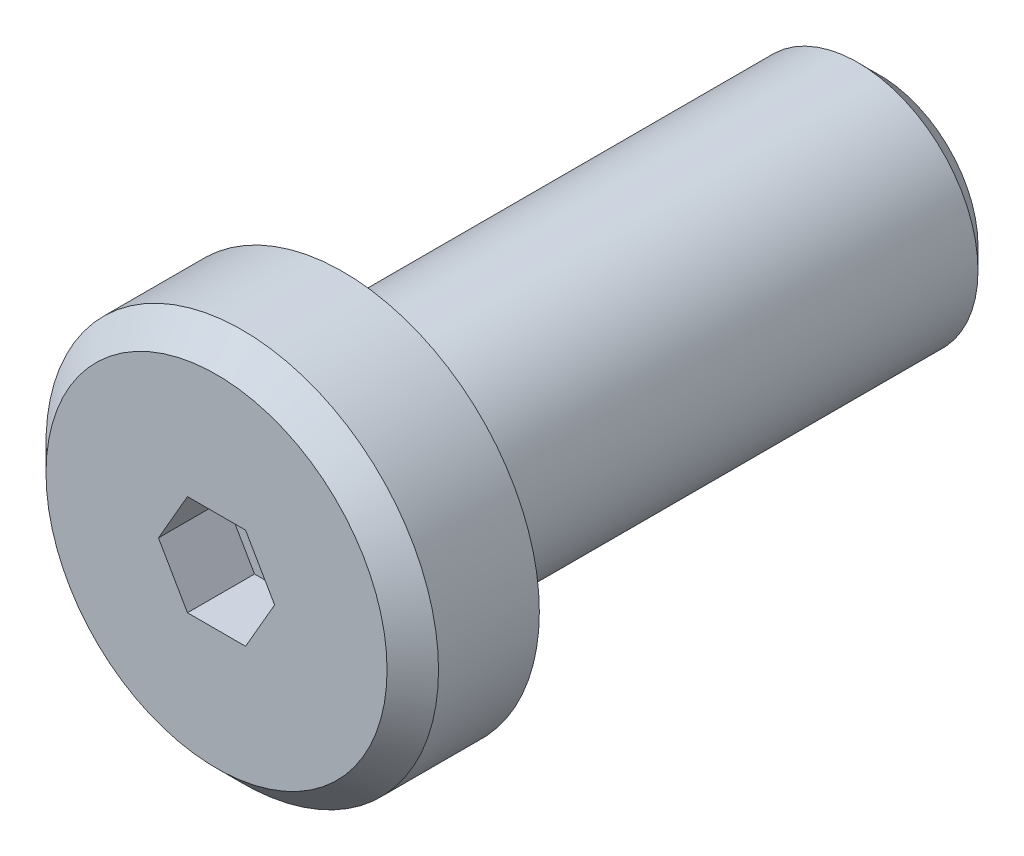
SolidWorks part; units mm, degrees
ref_plane "Plane1" through (0, 0, 0) normal (0, 0, 1) x (1, 0, 0)
ref_plane "Plane2" through (0, 0, 0) normal (0, 1, 0) x (1, 0, 0)
ref_plane "Plane3" through (0, 0, 0) normal (1, 0, 0) x (0, 0, -1)
other "Configuration Table"
sketch "Sketch1" plane through (0, 0, 0) normal (0, 0, 1) x (1, 0, 0)
  circle A0 centre (0, 0) radius 2.3241
  dimension "Head Dia." = 4.6482
extrude "Head" add sketch "Sketch1" against normal blind 1.4986
sketch "Sketch2" plane through (0, 0, -1.4986) normal (0, 0, -1) x (-1, 0, 0)
  circle A0 centre (0, 0) radius 1.4224
  dimension "Shaft O.D." = 2.8448
extrude "Shank" add sketch "Sketch2" along normal blind 6.35
sketch "Sketch3" plane through (0, 0, 0) normal (0, 0, 1) x (1, 0, 0)
  line L1 (0.6878, 0) -> (0.3439, 0.5956)
  line L2 (0.3439, 0.5956) -> (-0.3439, 0.5956)
  line L3 (-0.3439, 0.5956) -> (-0.6878, 0)
  line L4 (-0.6878, 0) -> (-0.3439, -0.5956)
  line L5 (-0.3439, -0.5956) -> (0.3439, -0.5956)
  line L6 (0.3439, -0.5956) -> (0.6878, 0)
  circle A0 centre (0, 0) radius 0.5956 construction
  dimension "Socket Size" = 1.1913
extrude "Socket" cut sketch "Sketch3" against normal blind 0.7937
chamfer "Bottom Chamfer" distance 0.254 angle 45 1 edges at (-1.4224, 0, -7.8486)
chamfer "Top Chamfer" distance 0.3048 angle 45 1 edges at (2.3241, 0, 0)
